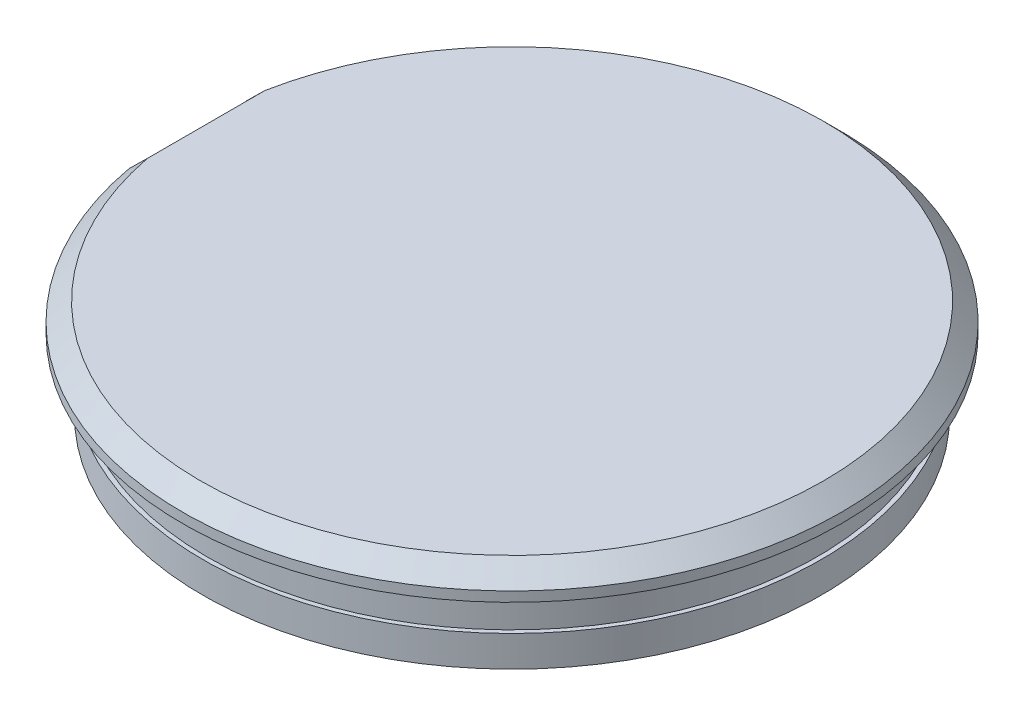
SolidWorks part; units mm, degrees
ref_plane "Front Plane" through (0, 0, 0) normal (0, 0, 1) x (1, 0, 0)
ref_plane "Top Plane" through (0, 0, 0) normal (0, 1, 0) x (1, 0, 0)
ref_plane "Right Plane" through (0, 0, 0) normal (1, 0, 0) x (0, 0, -1)
sketch "Sketch2" plane through (0, 0, 0) normal (0, 0, 1) x (1, 0, 0)
  line L0 (0, 0) -> (0, 6.9784) construction
  line L1 (0, 0.092) -> (10.5, 0.092)
  line L2 (10.5, 0.092) -> (10.5, 1.142)
  line L3 (10.5, 1.142) -> (10.35, 1.142)
  line L4 (10.35, 1.142) -> (10.35, 2.542)
  line L5 (0, 3.4892) -> (0, 0.092)
  line L6 (10.35, 2.542) -> (11.186, 2.542)
  line L7 (11.186, 2.542) -> (11.186, 2.8764)
  line L8 (11.186, 2.8764) -> (10.5732, 3.4892)
  line L9 (10.5732, 3.4892) -> (0, 3.4892)
  dimension "D1" = 10.35
  dimension "D2" = 10.5
  dimension "D3" = 1.05
  dimension "D4" = 1.4
  dimension "D5" = 135
revolve "Revolve1" add sketch "Sketch2" angle 360 about L0
sketch "Sketch3" plane through (0, 3.4892, 0) normal (0, 1, 0) x (1, 0, 0)
  line L0 (-10.3835, 1.9938) -> (-10.3835, -1.9938)
  line L1 (-11.9884, -1.9938) -> (-10.3835, -1.9938)
  line L2 (-11.9884, -1.9938) -> (-11.9884, 1.9938)
  line L3 (-11.9884, 1.9938) -> (-10.3835, 1.9938)
  line L5 (-11.9884, -1.9938) -> (-10.3835, 1.9938) construction
  line L6 (-11.9884, 1.9938) -> (-10.3835, -1.9938) construction
  circle A0 centre (0, 0) radius 11.186 construction
  circle A1 centre (0, 0) radius 10.5732 construction
  point P0 (-11.186, 0)
  dimension "D1" = 3.9876
extrude "Cut-Extrude1" cut sketch "Sketch3" against normal blind 10
sketch "Sketch4" plane through (-10.3835, 0, 0) normal (-1, 0, 0) x (0, 0, 1)
  line L0 (-1.9938, 2.542) -> (1.9938, 2.542) construction
  line L1 (1.9938, 2.542) -> (-1.9938, 2.542)
  line L2 (1.9938, 2.542) -> (1.9938, 3.0436)
  line L3 (1.9938, 3.0436) -> (-1.9938, 3.0436)
  line L4 (-1.9938, 2.542) -> (-1.9938, 3.0436)
  line L5 (-1.9938, 2.8764) -> (-1.9938, 3.4892) construction
  line L6 (1.9938, 3.4892) -> (1.9938, 2.8764) construction
extrude "Cut-Extrude2" cut sketch "Sketch4" against normal blind 1
